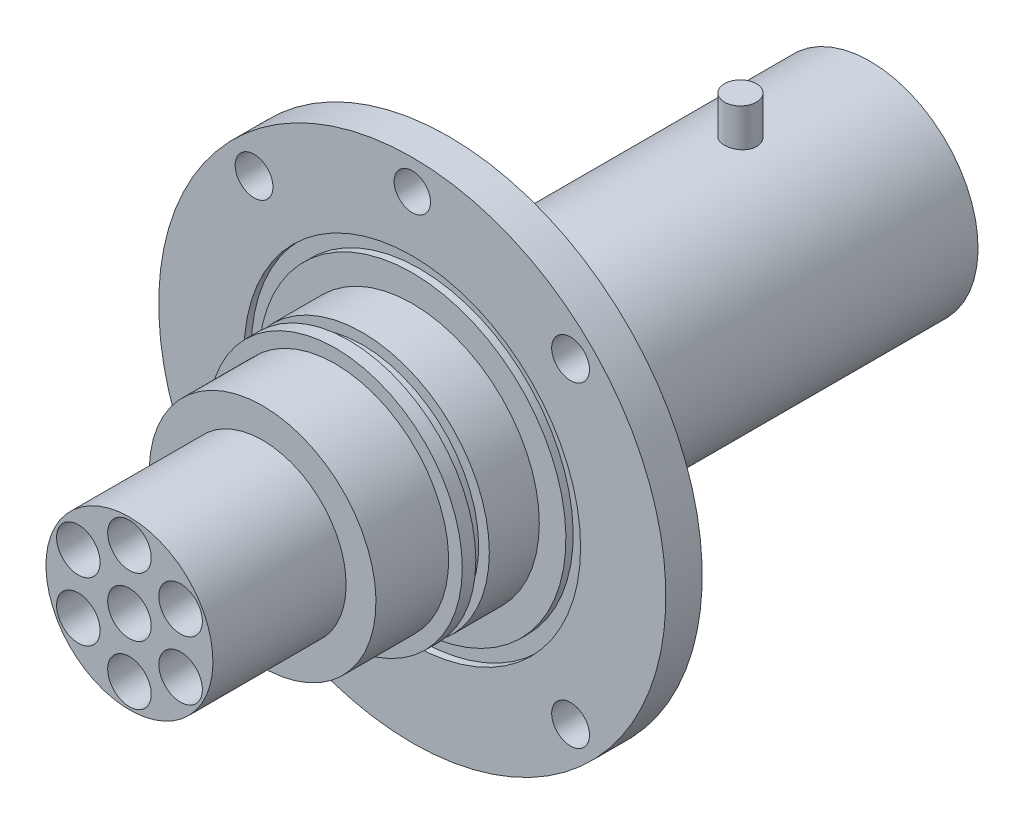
SolidWorks part; units mm, degrees
ref_plane "Front Plane" through (0, 0, 0) normal (0, 0, 1) x (1, 0, 0)
ref_plane "Top Plane" through (0, 0, 0) normal (0, 1, 0) x (1, 0, 0)
ref_plane "Right Plane" through (0, 0, 0) normal (1, 0, 0) x (0, 0, -1)
sketch "Sketch1" plane through (0, 0, 0) normal (1, 0, 0) x (0, 0, -1)
  line L0 (0, 0) -> (-91.5571, 0) construction
  line L1 (0, 22.1996) -> (0, 26.8478)
  line L2 (0, 44.323) -> (6.35, 44.323)
  line L3 (6.35, 44.323) -> (6.35, 27.94)
  line L4 (14.6812, 27.94) -> (14.6812, 18.8722)
  line L5 (14.6812, 18.8722) -> (80.01, 18.8722)
  line L7 (80.01, 18.8722) -> (80.01, 14.5927)
  line L8 (80.01, 14.5927) -> (6.127, 14.5927)
  line L9 (6.127, 14.5927) -> (6.127, 0)
  line L10 (6.127, 0) -> (0, 0)
  line L11 (0, 22.1996) -> (-8.7376, 22.1996)
  line L12 (-8.7376, 22.1996) -> (-8.7376, 20.3357)
  line L13 (-8.7376, 20.3357) -> (-11.0998, 20.3357)
  line L14 (-11.0998, 20.3357) -> (-11.0998, 22.1996)
  line L15 (-11.0998, 22.1996) -> (-13.462, 22.1996)
  line L16 (-13.462, 22.1996) -> (-13.462, 19.812)
  line L17 (0, 29.4132) -> (0, 44.323)
  line L21 (-13.462, 19.812) -> (-26.162, 19.812)
  line L22 (-26.162, 19.812) -> (-26.162, 0)
  line L23 (-26.162, 0) -> (0, 0)
  line L25 (14.6812, 27.94) -> (6.35, 27.94)
  line L26 (0, 29.4132) -> (1.27, 29.4132)
  line L27 (1.27, 29.4132) -> (1.27, 26.8478)
  line L28 (1.27, 26.8478) -> (0, 26.8478)
  dimension "D1" = 88.646
  dimension "D2" = 6.35
  dimension "D3" = 44.3992
  dimension "D4" = 13.462
  dimension "D5" = 39.624
  dimension "D6" = 53.6956
  dimension "D7" = 80.01
  dimension "D8" = 106.172
  dimension "D9" = 2.3622
  dimension "D10" = 2.3622
  dimension "D11" = 1.27
  dimension "D12" = 2.5654
  dimension "D13" = 37.7444
  dimension "D14" = 65.3288
  dimension "D15" = 40.6714
revolve "Revolve1" add sketch "Sketch1" angle 360 about L0
sketch "Sketch2" plane through (0, 0, 0) normal (0, 0, 1) x (1, 0, 0)
  line L0 (0, 0) -> (27.6592, 27.6592) construction
  line L1 (0, 0) -> (62.1148, 0) construction
  circle A0 centre (0, 0) radius 39.116 construction
  circle A1 centre (0, 39.116) radius 3.175
  circle A2 centre (27.6592, 27.6592) radius 3.302
  circle A3 centre (27.6602, -27.6582) radius 3.302
  circle A4 centre (-27.6572, -27.6592) radius 3.302
  circle A5 centre (-27.6582, 27.6582) radius 3.302
  dimension "D1" = 6.35
  dimension "D2" = 78.232
  dimension "D3" = 6.604
  dimension "D4" = 45
  dimension "D5" = 4
extrude "Cut-Extrude1" cut sketch "Sketch2" against normal through all
sketch "Sketch7" plane through (0, 0, 0) normal (0, 1, 0) x (1, 0, 0)
  line L0 (27.94, 14.6812) -> (-27.94, 14.6812) construction
  circle A0 centre (0, 57.3532) radius 2.794
  dimension "D2" = 5.588
  dimension "D1" = 42.672
extrude "Boss-Extrude2" add sketch "Sketch7" along normal blind 9.525 from offset 15.875
sketch "Sketch6" plane through (0, 0, -6.127) normal (0, 0, -1) x (-1, 0, 0)
  circle A0 centre (0, 0) radius 3.8062
  circle A1 centre (0, 10.3187) radius 3.8062
  circle A2 centre (0, 0) radius 10.3187 construction
  circle A3 centre (8.9363, 5.1594) radius 3.8062
  circle A4 centre (8.9363, -5.1594) radius 3.8062
  circle A5 centre (0, -10.3188) radius 3.8062
  circle A6 centre (-8.9363, -5.1594) radius 3.8062
  circle A7 centre (-8.9363, 5.1594) radius 3.8062
  circle A8 centre (0, 0) radius 14.5927 construction
  circle A9 centre (0, 0) radius 14.5927
  dimension "D2" = 20.6375
  dimension "D3" = 7.6125
  dimension "D1" = 6
extrude "Boss-Extrude1" add sketch "Sketch6" along normal blind 73.025 and the other way blind 55.5625
equation "\"Buoyancy\"=\"SW-Volume\"*(\"SW-Density\"-.037062)"
